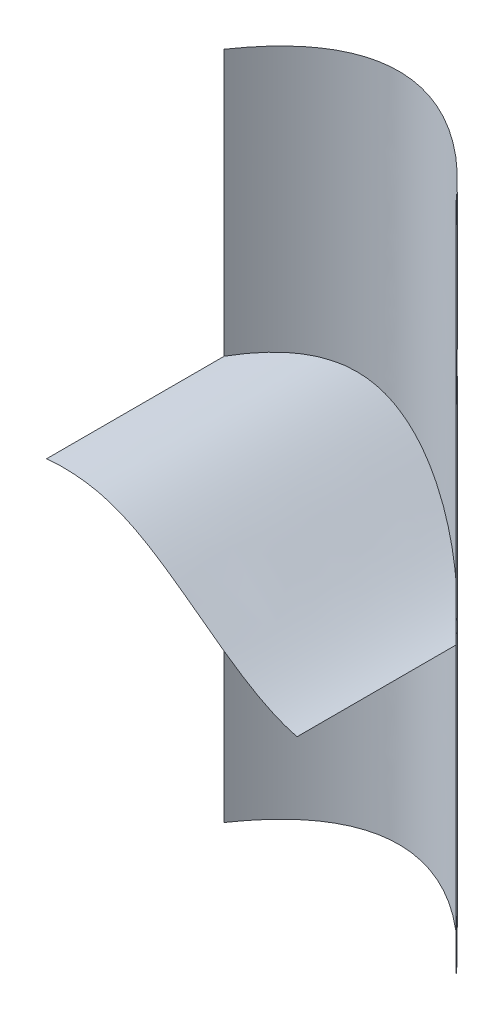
SolidWorks part; units mm, degrees
ref_plane "Front" through (0, 0, 0) normal (0, 0, 1) x (1, 0, 0)
ref_plane "Top" through (0, 0, 0) normal (0, 1, 0) x (1, 0, 0)
ref_plane "Right" through (0, 0, 0) normal (1, 0, 0) x (0, 0, -1)
sketch "Sketch1" plane through (0, 0, 0) normal (0, 0, 1) x (1, 0, 0)
  spline_without_curve S0
surface "Surface-Extrude1" sketch "Sketch1" parameters "D1"=101
sketch "Sketch4" plane through (0, 0, 0) normal (0, 1, 0) x (1, 0, 0)
  line L1 (1.5801, -14.851) -> (95.9667, -14.851)
  line L2 (1.5801, -14.851) -> (1.5801, -54.2735)
  line L3 (1.5801, -54.2735) -> (95.9667, -54.2735)
  line L4 (95.9667, -14.851) -> (95.9667, -54.2735)
surface "Surface-Trim11"
surface "Surface-Untrim1"
sketch "Sketch5" plane through (0, 0, 0) normal (0, 1, 0) x (1, 0, 0)
  spline S0 degree 3 poles (-30.259, -2.7528) (-6.7686, 31.4489) (20.8655, 10.834) (37.0698, -7.8221) knots 0 0 0 0 1 1 1 1
surface "Surface-Extrude3" sketch "Sketch5" parameters "D1"=90, "D2"=90
surface "Surface-Trim13"
